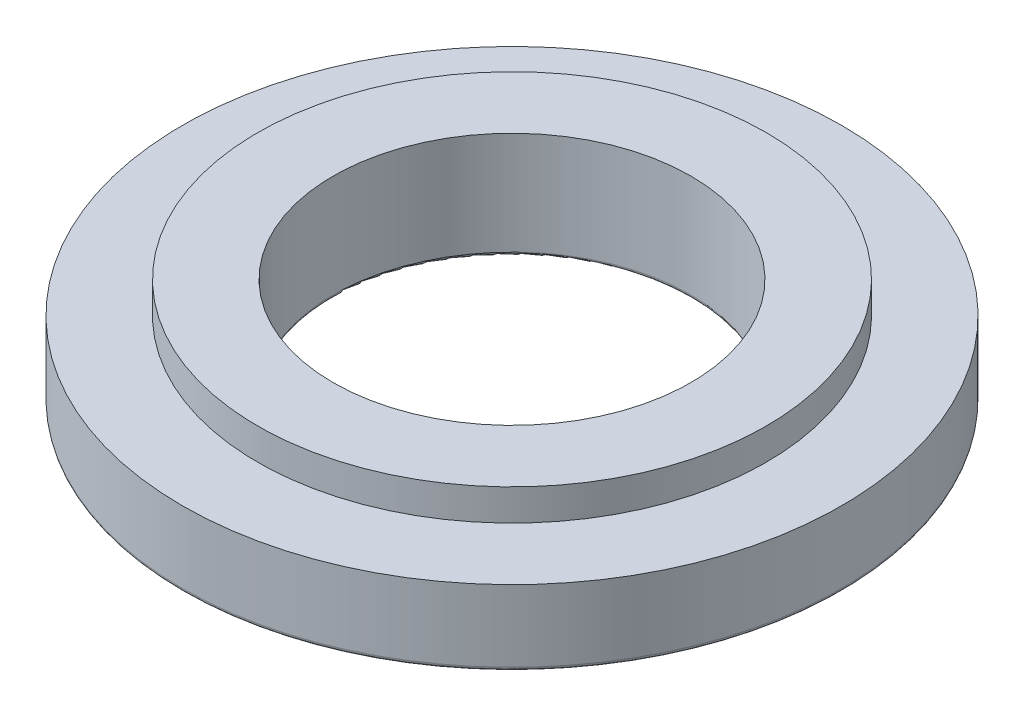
SolidWorks part; units mm, degrees
ref_plane "Front Plane" through (0, 0, 0) normal (0, 0, 1) x (1, 0, 0)
ref_plane "Top Plane" through (0, 0, 0) normal (0, 1, 0) x (1, 0, 0)
ref_plane "Right Plane" through (0, 0, 0) normal (1, 0, 0) x (0, 0, -1)
sketch "Sketch1" plane through (0, 0, 0) normal (0, 0, 1) x (1, 0, 0)
  line L0 (7.125, 0) -> (7.125, 4.25)
  line L1 (7.125, 4.25) -> (10.125, 4.25)
  line L2 (10.125, 4.25) -> (10.125, 3)
  line L3 (10.125, 3) -> (13.125, 3)
  line L4 (13.125, 3) -> (13.125, 0)
  line L5 (13.125, 0) -> (7.125, 0)
  line L6 (0, 0) -> (0, 14.9267) construction
  dimension "D1" = 7.125
  dimension "D2" = 3
  dimension "D3" = 3
  dimension "D4" = 4.25
  dimension "D5" = 6
revolve "Revolve1" add sketch "Sketch1" angle 360 about L6
fillet "Fillet1" radius 0.15 2 edges at (0, 0, -7.125) (0, 0, -13.125)
